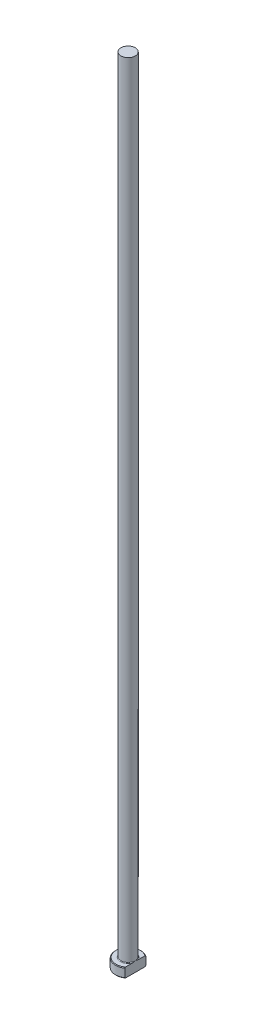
SolidWorks part; units mm, degrees
ref_plane "Front Plane" through (0, 0, 0) normal (0, 0, 1) x (1, 0, 0)
ref_plane "Top Plane" through (0, 0, 0) normal (0, 1, 0) x (1, 0, 0)
ref_plane "Right Plane" through (0, 0, 0) normal (1, 0, 0) x (0, 0, -1)
sketch "Sketch1" plane through (0, 0, 0) normal (0, 0, 1) x (1, 0, 0)
  line L0 (0, 259.9588) -> (0, -15.1925) construction
  line L1 (0, 0) -> (-4, 0)
  line L2 (-4, 0) -> (-4, 3)
  line L3 (-4, 3) -> (-2.25, 3)
  line L4 (-2.25, 3) -> (-2.25, 250)
  line L5 (-2.25, 250) -> (0, 250)
  line L6 (0, 250) -> (0, 0)
  dimension "L" = 250
  dimension "H" = 8
  dimension "T" = 3
  dimension "D" = 4.5
revolve "Revolve1" add sketch "Sketch1" angle 360 about L0
chamfer "Chamfer1" distance 0.2 angle 45 2 edges at (0, 3, 4) (0, 0, 4)
fillet "Fillet1" radius 0.2 1 edges at (0, 3, 2.25)
sketch "Sketch2" plane through (0, 0, 0) normal (0, 1, 0) x (1, 0, 0)
  line L0 (2.25, 3.3072) -> (2.25, -3.3072)
  circle A0 centre (0, 0) radius 4 construction
  arc A1 (2.25, -3.3072) -> (2.25, 3.3072) centre (0, 0) ccw
  circle A2 centre (0, 0) radius 2.25 construction
extrude "KEY" cut sketch "Sketch2" along normal through all
